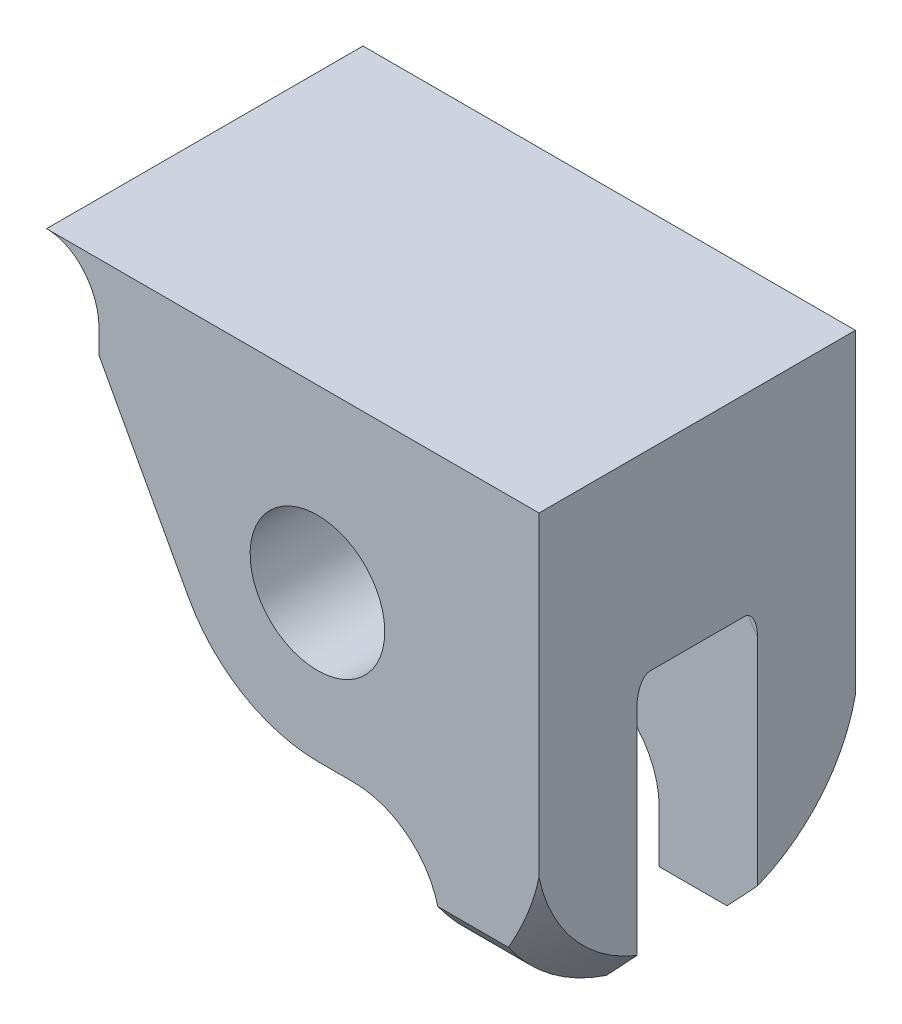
SolidWorks part; units mm, degrees
ref_plane "Ebene vorne" through (0, 0, 0) normal (0, 0, 1) x (1, 0, 0)
ref_plane "Ebene oben" through (0, 0, 0) normal (0, 1, 0) x (1, 0, 0)
ref_plane "Ebene rechts" through (0, 0, 0) normal (1, 0, 0) x (0, 0, -1)
body saved out of another part "Basisteil-Part1-1"
sketch3d "3D-Skizze1"
  spline S0 degree 3 poles (-20.0616, -8.9396, -1.3716) (-20.1317, -8.9684, -0.9162) (-20.1724, -8.9859, -0.4601) (-20.1727, -8.986, 0.4543) (-20.1322, -8.9686, 0.9128) (-20.0616, -8.9396, 1.3716) knots 0 0 0 0 0.5 0.5 1 1 1 1 construction
  point P0 (-20.1726, -8.9859, 0)
